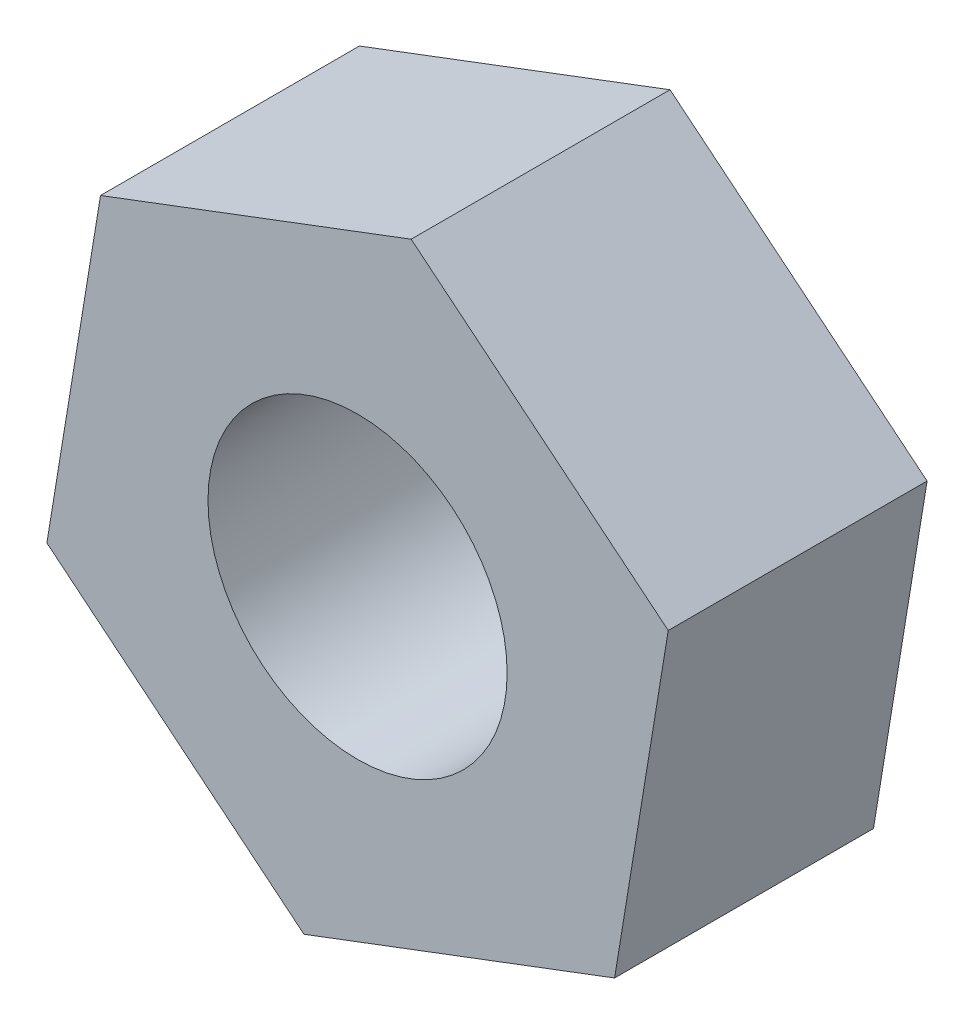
SolidWorks part; units mm, degrees
ref_plane "前视基准面" through (0, 0, 0) normal (0, 0, 1) x (1, 0, 0)
ref_plane "上视基准面" through (0, 0, 0) normal (0, 1, 0) x (1, 0, 0)
ref_plane "右视基准面" through (0, 0, 0) normal (1, 0, 0) x (0, 0, -1)
sketch "草图2" plane through (0, 0, 0) normal (0, 0, 1) x (1, 0, 0)
  line L0 (-4.4684, 3.656) -> (4.4684, -3.656) construction
  line L1 (4.4684, -3.656) -> (5.4004, 2.0418)
  line L2 (5.4004, 2.0418) -> (0.932, 5.6978)
  line L3 (0.932, 5.6978) -> (-4.4684, 3.656)
  line L4 (-4.4684, 3.656) -> (-5.4004, -2.0418)
  line L5 (-5.4004, -2.0418) -> (-0.932, -5.6978)
  line L6 (-0.932, -5.6978) -> (4.4684, -3.656)
  line L7 (0.932, 5.6978) -> (-0.932, -5.6978) construction
  circle A0 centre (0, 0) radius 5 construction
  dimension "D1" = 10
extrude "凸台-拉伸1" add sketch "草图2" along normal blind 4.5
hole_wizard "G1/16 螺纹孔1" positions "3D草图3" profile "草图5" tap size "G1/16" standard "ISO"
sketch3d "3D草图3"
  line L0 (0.932, 5.6978, 0) -> (-0.932, -5.6978, 0) construction
  point P0 (0, 0, 0)
  point P4 (0, 0, 0)
sketch "草图5" plane through (0, 0, 0) normal (1, 0, 0) x (0, 1, 0)
  line L0 (0, 0) -> (0, 18.17)
  line L1 (0, 18.17) -> (2.6, 18.17)
  line L2 (2.6, 18.17) -> (2.6, 0)
  line L5 (2.6, 0) -> (0, 0)
  line L10 (0, 18.17) -> (-2.6, 18.17) construction
  line L11 (0, -6.35) -> (0, 107.95) construction
  dimension "螺纹孔钻头直径" = 5.2
  dimension "螺纹孔钻头深度" = 18.17
  dimension "导头角度" = 180
